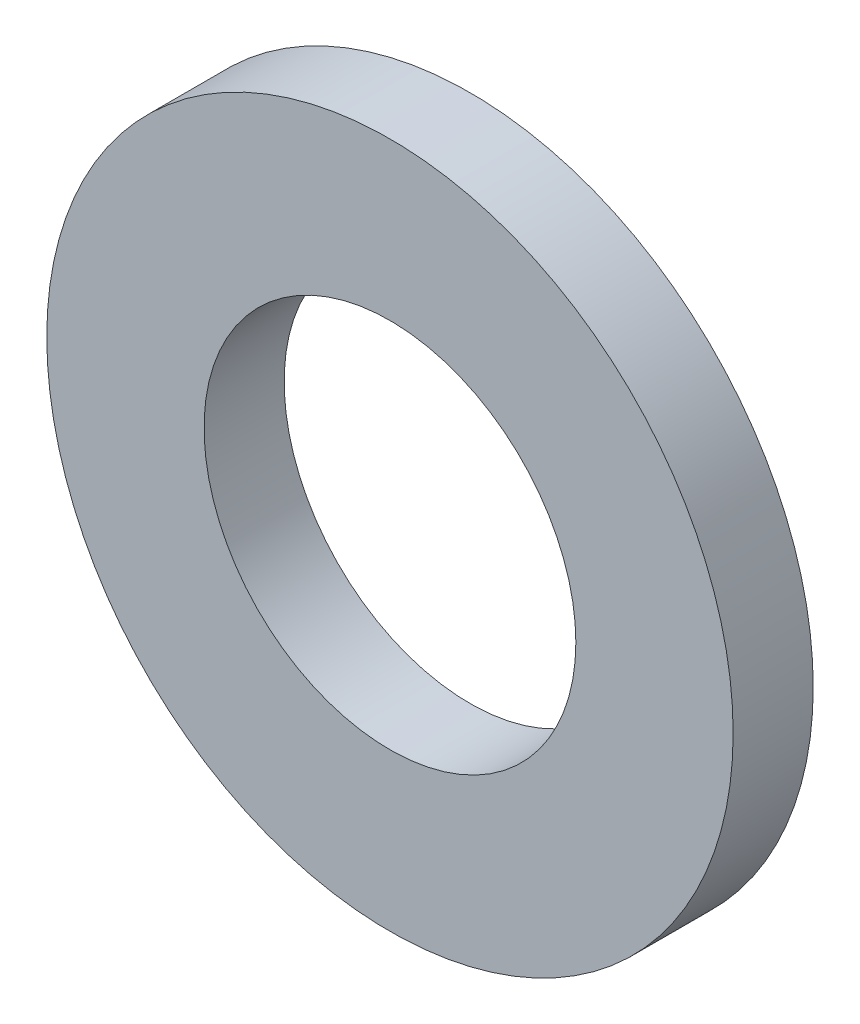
SolidWorks part; units mm, degrees
ref_plane "Plan de face" through (0, 0, 0) normal (0, 0, 1) x (1, 0, 0)
ref_plane "Plan de dessus" through (0, 0, 0) normal (0, 1, 0) x (1, 0, 0)
ref_plane "Plan de droite" through (0, 0, 0) normal (1, 0, 0) x (0, 0, -1)
sketch "Esquisse1" plane through (0, 0, 0) normal (0, 0, 1) x (1, 0, 0)
  circle A0 centre (0, 0) radius 3.25
  circle A1 centre (0, 0) radius 6
  dimension "D1" = 6.5
  dimension "D2" = 12
extrude "Boss.-Extru.1" add sketch "Esquisse1" along normal blind 1.4
